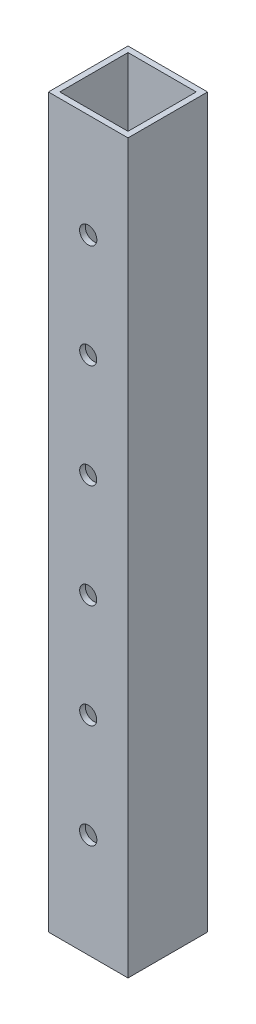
SolidWorks part; units mm, degrees
ref_plane "Front Plane" through (0, 0, 0) normal (0, 0, 1) x (1, 0, 0)
ref_plane "Top Plane" through (0, 0, 0) normal (0, 1, 0) x (1, 0, 0)
ref_plane "Right Plane" through (0, 0, 0) normal (1, 0, 0) x (0, 0, -1)
sketch "Sketch1" plane through (0, 0, 0) normal (0, 1, 0) x (1, 0, 0)
  line L1 (-28.575, 15.875) -> (15.875, 15.875)
  line L2 (-28.575, 15.875) -> (-28.575, -28.575)
  line L3 (-28.575, -28.575) -> (15.875, -28.575)
  line L4 (15.875, 15.875) -> (15.875, -28.575)
  line L5 (-25.4, 12.7) -> (12.7, 12.7)
  line L6 (-25.4, 12.7) -> (-25.4, -25.4)
  line L7 (-25.4, -25.4) -> (12.7, -25.4)
  line L8 (12.7, 12.7) -> (12.7, -25.4)
  dimension "D1" = 15.875
  dimension "D2" = 44.45
  dimension "D3" = 44.45
  dimension "D4" = 15.875
  dimension "D5" = 3.175
  dimension "D6" = 3.175
  dimension "D7" = 3.175
  dimension "D8" = 3.175
extrude "Boss-Extrude1" add sketch "Sketch1" along normal blind 406.4 contours L1 L4 L3 L2 | L6 L7 L8 L5
sketch "hole sketch" plane through (0, 0, -15.875) normal (0, 0, -1) x (-1, 0, 0)
  line L1 (-15.875, 203.2) -> (28.575, 203.2) construction
  line L2 (-15.875, 406.4) -> (-15.875, 0) construction
  line L3 (28.575, 406.4) -> (28.575, 0) construction
  line L6 (28.575, 406.4) -> (-15.875, 406.4) construction
  circle A0 centre (6.35, 348.3429) radius 4.826
  circle A1 centre (6.35, 290.2857) radius 4.7625
  circle A2 centre (6.35, 232.2286) radius 4.7625
  point P4 (28.575, 203.2)
  point P15 (6.35, 406.4)
  dimension "D6" = 58.0571
  dimension "D7" = 9.525
  dimension "D1" = 9.652
  dimension "D3" = 9.525
  dimension "D2" = 0
  dimension "D4" = 58.0571
  dimension "D5" = 58.0571
extrude "Cut-Extrude1" cut sketch "hole sketch" against normal through all
sketch "reference sketch for mirror plane" plane through (0, 0, -15.875) normal (0, 0, -1) x (-1, 0, 0)
  line L0 (28.575, 406.4) -> (28.575, 0) construction
  line L1 (28.575, 406.4) -> (28.575, 0)
  point P2 (28.575, 203.2)
ref_plane "mirror plane at midpoint" through (0, 203.2, 0) normal (0, 1, 0) x (1, 0, 0)
mirror "mirror for holes" about plane through (0, 203.2, 0) normal (0, 1, 0) of "Cut-Extrude1"
equation "\"height\"= \"x@Boss-Extrude1\""
equation "\"hole_distance\"= \"height\" / 4"
equation "\"D4@hole sketch\"=\"height\"/7"
equation "\"D5@hole sketch\"=\"height\"/7"
equation "\"D6@hole sketch\"=\"height\"/7"
